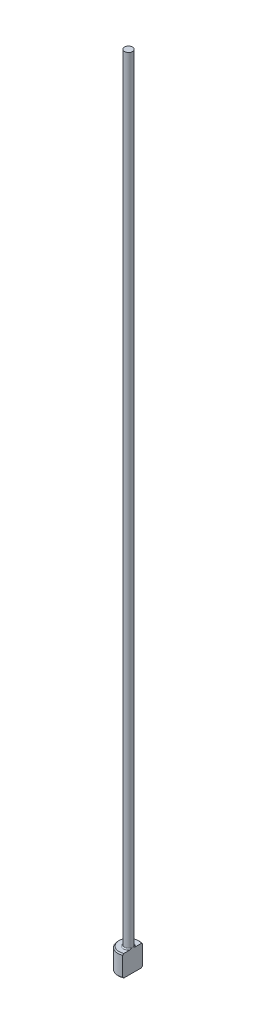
SolidWorks part; units mm, degrees
ref_plane "Front Plane" through (0, 0, 0) normal (0, 0, 1) x (1, 0, 0)
ref_plane "Top Plane" through (0, 0, 0) normal (0, 1, 0) x (1, 0, 0)
ref_plane "Right Plane" through (0, 0, 0) normal (1, 0, 0) x (0, 0, -1)
sketch "Sketch1" plane through (0, 0, 0) normal (0, 0, 1) x (1, 0, 0)
  line L0 (0, 259.9588) -> (0, -15.1925) construction
  line L1 (0, 0) -> (-2, 0)
  line L2 (-2, 0) -> (-2, 4)
  line L3 (-2, 4) -> (-0.75, 4)
  line L4 (-0.75, 4) -> (-0.75, 150)
  line L5 (-0.75, 150) -> (0, 150)
  line L6 (0, 150) -> (0, 0)
  dimension "L" = 150
  dimension "H" = 4
  dimension "T" = 4
  dimension "D" = 1.5
revolve "Revolve1" add sketch "Sketch1" angle 360 about L0
chamfer "Chamfer1" distance 0.2 angle 45 2 edges at (0, 4, 2) (0, 0, 2)
fillet "Fillet1" radius 0.2 1 edges at (0, 4, 0.75)
sketch "Sketch2" plane through (0, 0, 0) normal (0, 1, 0) x (1, 0, 0)
  line L0 (0.75, -1.854) -> (0.75, 1.854)
  circle A0 centre (0, 0) radius 2 construction
  arc A1 (0.75, -1.854) -> (0.75, 1.854) centre (0, 0) ccw
  circle A2 centre (0, 0) radius 0.75 construction
extrude "KEYED HEAD" cut sketch "Sketch2" along normal through all
